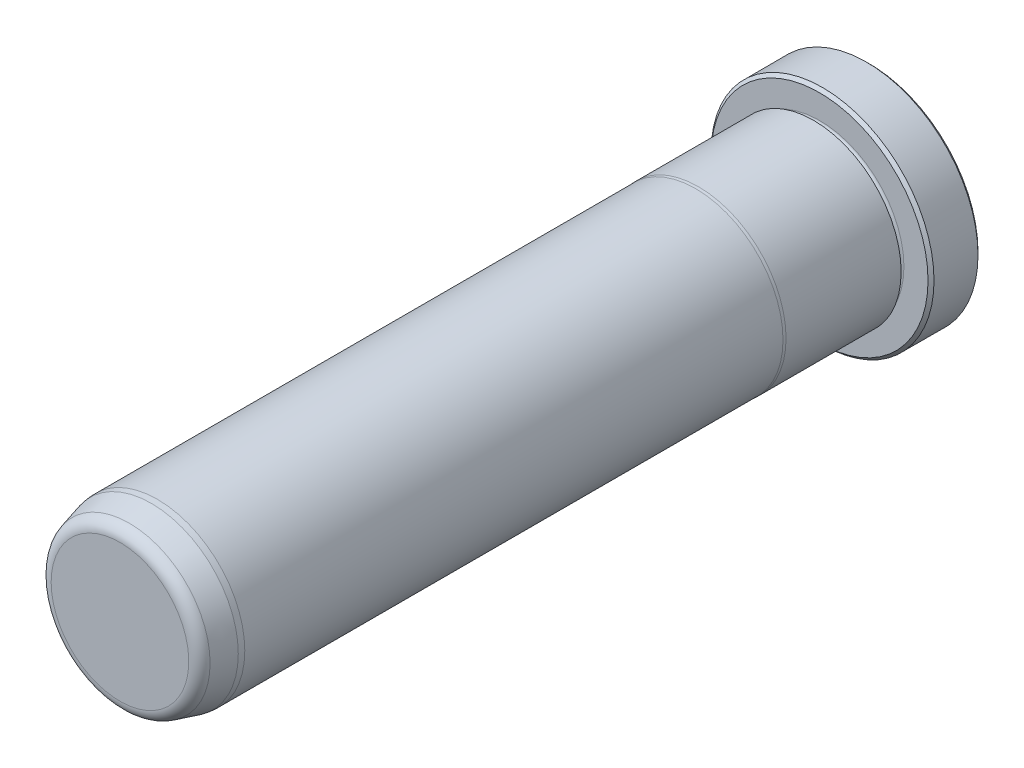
SolidWorks part; units mm, degrees
ref_plane "Front Plane" through (0, 0, 0) normal (0, 0, 1) x (1, 0, 0)
ref_plane "Top Plane" through (0, 0, 0) normal (0, 1, 0) x (1, 0, 0)
ref_plane "Right Plane" through (0, 0, 0) normal (1, 0, 0) x (0, 0, -1)
sketch "Sketch1" plane through (0, 0, 0) normal (1, 0, 0) x (0, 0, -1)
  line L0 (0, 0) -> (0, 14.1605)
  line L1 (0, 14.1605) -> (-6.35, 14.1605)
  line L2 (-6.35, 14.1605) -> (-6.35, 10.7188)
  line L3 (-6.35, 10.3378) -> (-7.112, 10.3378) construction
  line L4 (-7.112, 10.7188) -> (-7.112, 11.1252)
  line L5 (-7.112, 11.1252) -> (-21.7348, 11.1252)
  line L6 (-21.7348, 11.1252) -> (-22.098, 11.0998)
  line L7 (-22.098, 11.0998) -> (-90.4875, 11.0998)
  line L9 (-95.25, 9.9612) -> (-95.25, 0)
  line L10 (-95.25, 0) -> (0, 0)
  line L11 (0, 0) -> (13.6287, 0) construction
  line L12 (-90.4875, 11.0998) -> (-91.2495, 11.0331)
  line L13 (-91.2495, 11.0331) -> (-95.25, 9.9612)
  arc A0 (-7.112, 10.7188) -> (-6.35, 10.7188) centre (-6.731, 10.7188) ccw
  dimension "D14" = 0.762
  dimension "D1" = 6.35
  dimension "D2" = 0.762
  dimension "D3" = 28.321
  dimension "D4" = 22.2504
  dimension "D5" = 22.098
  dimension "D6" = 95.25
  dimension "D7" = 0.7874
  dimension "D8" = 4
  dimension "D9" = 22.1996
  dimension "D10" = 5
  dimension "D11" = 15
  dimension "D12" = 0.762
  dimension "D13" = 4.7625
revolve "Revolve1" add sketch "Sketch1" angle 360 about L11
fillet "Fillet6" radius 1.5875 1 edges at (9.9612, 0, 95.25)
chamfer "Chamfer1" distance 0.381 angle 45 2 edges at (14.1605, 0, 0) (14.1605, 0, 6.35)
